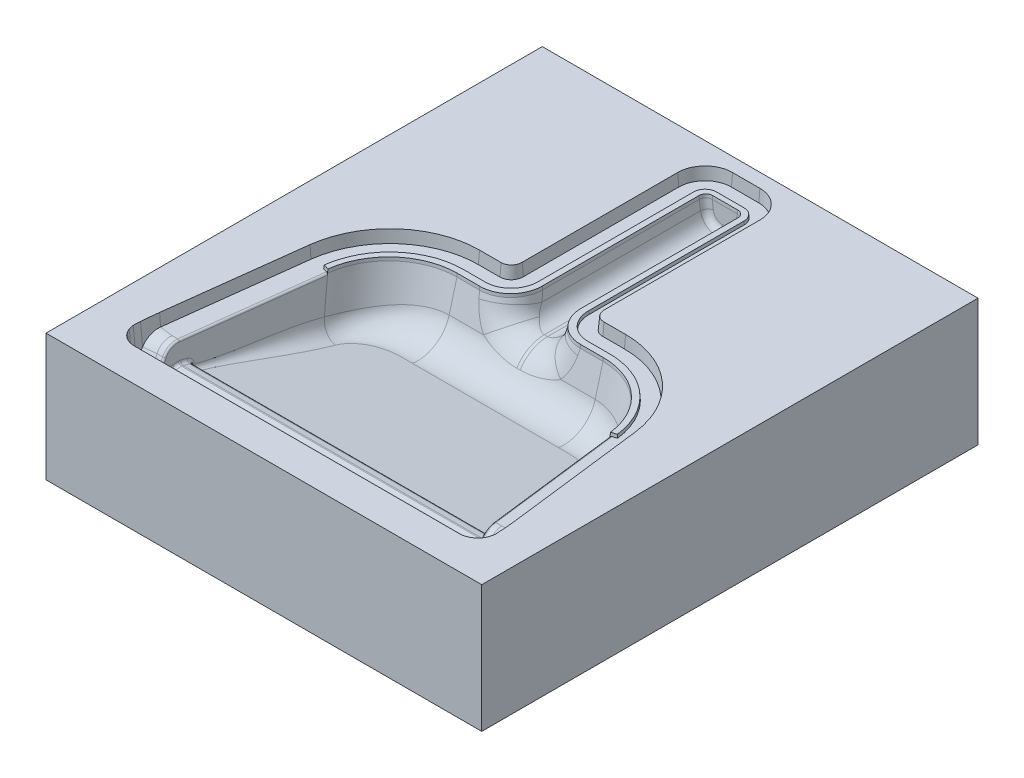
SolidWorks part; units mm, degrees
ref_plane "Front Plane" through (0, 0, 0) normal (0, 0, 1) x (1, 0, 0)
ref_plane "Top Plane" through (0, 0, 0) normal (0, 1, 0) x (1, 0, 0)
ref_plane "Right Plane" through (0, 0, 0) normal (1, 0, 0) x (0, 0, -1)
body saved out of another part "Stock-Dustpan_Source_&-1"
sketch "Sketch1" plane through (0, 0, 0) normal (1, 0, 0) x (0, 0, -1)
  line L0 (0, 105) -> (410, 105)
  line L1 (0, 0) -> (0, 125) construction
  line L2 (410, 0) -> (410, 125) construction
  line L3 (410, 125) -> (0, 125) construction
  dimension "D1" = 20
extrude "Cut-Extrude1" cut sketch "Sketch1" against normal through all and the other way through all
